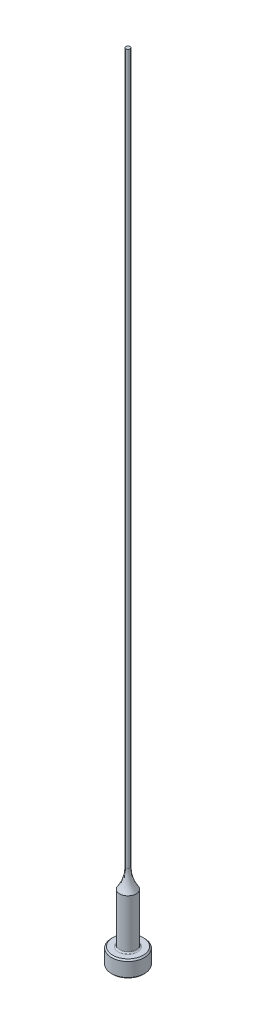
SolidWorks part; units mm, degrees
ref_plane "Front Plane" through (0, 0, 0) normal (0, 0, 1) x (1, 0, 0)
ref_plane "Top Plane" through (0, 0, 0) normal (0, 1, 0) x (1, 0, 0)
ref_plane "Right Plane" through (0, 0, 0) normal (1, 0, 0) x (0, 0, -1)
sketch "Sketch1" plane through (0, 0, 0) normal (0, 0, 1) x (1, 0, 0)
  line L0 (0, 259.9588) -> (0, -15.1925) construction
  line L1 (0, 0) -> (-3.175, 0)
  line L2 (-3.175, 0) -> (-3.175, 3.175)
  line L3 (-3.175, 3.175) -> (-1.5875, 3.175)
  line L4 (-0.3962, 16.4027) -> (-0.3962, 152.4)
  line L5 (-0.3962, 152.4) -> (0, 152.4)
  line L6 (0, 152.4) -> (0, 0)
  line L7 (-1.5875, 3.175) -> (-1.5875, 12.7)
  arc A0 (-1.5875, 12.7) -> (-0.3962, 16.4027) centre (-6.7462, 16.4027) ccw
  point P13 (-1.5875, 0)
  dimension "D1" = 6.35
  dimension "L" = 152.4
  dimension "D2" = 3.175
  dimension "H" = 6.35
  dimension "T" = 3.175
  dimension "D" = 0.7925
  dimension "S" = 12.7
revolve "Revolve1" add sketch "Sketch1" angle 360 about L0
chamfer "Chamfer1" distance 0.254 angle 45 2 edges at (0, 3.175, 3.175) (0, 0, 3.175)
fillet "Fillet1" radius 0.254 1 edges at (0, 3.175, 1.5875)
